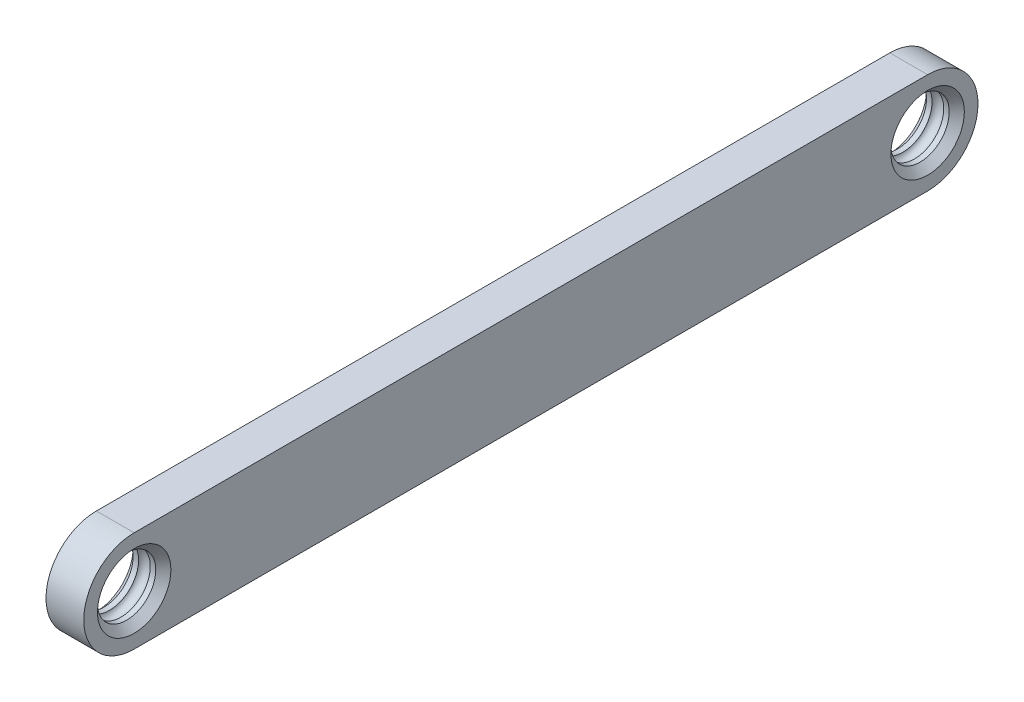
SolidWorks part; units mm, degrees
ref_plane "Front Plane" through (0, 0, 0) normal (0, 0, 1) x (1, 0, 0)
ref_plane "Top Plane" through (0, 0, 0) normal (0, 1, 0) x (1, 0, 0)
ref_plane "Right Plane" through (0, 0, 0) normal (1, 0, 0) x (0, 0, -1)
sketch "Sketch1" plane through (0, 0, 0) normal (1, 0, 0) x (0, 0, -1)
  line L0 (0, 0) -> (100, 0) construction
  line L1 (0, 6.35) -> (100, 6.35)
  line L2 (0, -6.35) -> (100, -6.35)
  arc A0 (0, 6.35) -> (0, -6.35) centre (0, 0) ccw
  arc A1 (100, -6.35) -> (100, 6.35) centre (100, 0) ccw
  circle A2 centre (0, 0) radius 3.175
  circle A3 centre (100, 0) radius 3.175
  circle A8 centre (0, 0) radius 3.675
  circle A9 centre (100, 0) radius 3.675
  point P3 (50, 0)
  dimension "D2" = 6.35
  dimension "D3" = 6.35
  dimension "D4" = 6.35
  dimension "D1" = 100
  dimension "D9" = 0.5
  dimension "D10" = 0.5
extrude "Boss-Extrude1" add sketch "Sketch1" along normal blind 4.7625
chamfer "Chamfer1" distance 0.9525 angle 45 4 edges at (4.7625, 0, -3.675) (0, 0, -3.675) (4.7625, 0, -103.675) (0, 0, -103.675)
sketch "Sketch2" plane through (0, 0, 0) normal (0, 1, 0) x (1, 0, 0)
  line L0 (3.81, 3.675) -> (3.81, -3.675) construction
  line L1 (0.4525, -3.675) -> (5.2078, -3.675) construction
  line L2 (0.4525, 3.675) -> (0.4525, -3.675)
  line L3 (0.4525, 3.675) -> (0.4525, -3.675) construction
  line L4 (3.81, 3.675) -> (3.81, -3.675) construction
  line L5 (4.7625, -6.35) -> (4.7625, 0) construction
  line L6 (0.4525, 0) -> (3.81, 0)
  circle A0 centre (2.3813, -3.375) radius 0.7938
  dimension "D2" = 2.3813
  dimension "D3" = 0.3
  dimension "D1" = 0.5
revolve "Cut-Revolve1" cut sketch "Sketch2" angle 360 about L6
sketch "Sketch3" plane through (0, 0, 0) normal (-1, 0, 0) x (0, 0, 1)
  circle A0 centre (-100, 0) radius 3.675 construction
  circle A5 centre (-100, 0) radius 3.675 construction
  point P16 (-100, 0)
pattern_sketch "Sketch-Pattern2" of "Cut-Revolve1"
